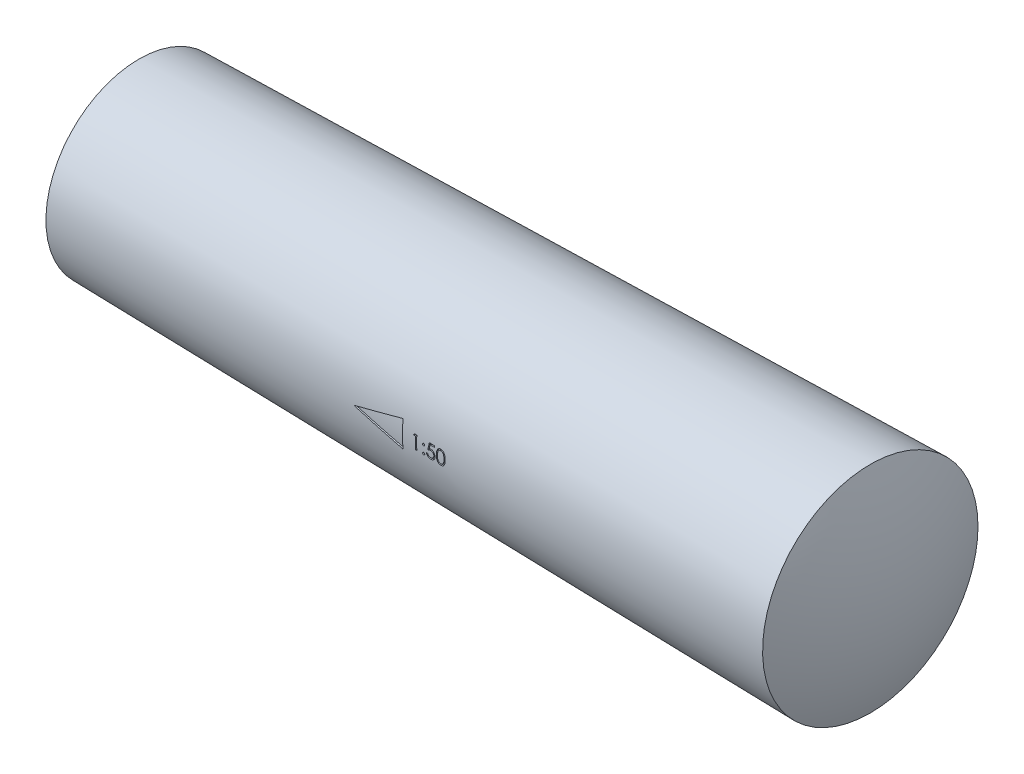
SolidWorks part; units mm, degrees
ref_plane "Front Plane" through (0, 0, 0) normal (0, 0, 1) x (1, 0, 0)
ref_plane "Top Plane" through (0, 0, 0) normal (0, 1, 0) x (1, 0, 0)
ref_plane "Right Plane" through (0, 0, 0) normal (1, 0, 0) x (0, 0, -1)
sketch "Sketch1" plane through (0, 0, 0) normal (1, 0, 0) x (0, 0, -1)
  circle A0 centre (0, 0) radius 7
  dimension "D1" = 14
extrude "Extrude1" add sketch "Sketch1" along normal mid plane 55
draft "Draft1" type of draft neutral plane draft angle 1.146 faces to draft 1 parameters "D1"=1.146
sketch "Sketch2" plane through (0, 0, 0) normal (0, 0, 1) x (1, 0, 0)
  line L0 (-27.5, 0) -> (-27.5, 7)
  line L1 (-27.5, 7) -> (-27.5, -7) construction
  line L2 (-27.5, 0) -> (-29.1, 0)
  line L3 (-29.1, 0) -> (-29.1, -7.55) construction
  line L4 (27.5, 0) -> (27.5, 8.1)
  line L5 (27.5, -8.1) -> (27.5, 8.1) construction
  line L6 (27.5, 0) -> (29.1, 0)
  line L7 (29.1, 0) -> (29.1, -7.55) construction
  line L8 (-27.5, -7) -> (27.5, -8.1) construction
  arc A0 (-29.1, 0) -> (-27.5, 7) centre (-12.9875, 0) cw
  arc A1 (29.1, 0) -> (27.5, 8.1) centre (7.7967, 0) ccw
  point P14 (0, -7.55)
revolve "Revolve1" add sketch "Sketch2" angle 360 about L2
sketch "Sketch5" plane through (0, 0, 0) normal (0, 0, 1) x (1, 0, 0)
  line L0 (0, 7.55) -> (0, -7.55) construction
  line L1 (27.5, 8.1) -> (-27.5, 7) construction
  line L2 (-27.5, -7) -> (27.5, -8.1) construction
ref_plane "Plane2" through (0, 0, 0) normal (-0.02, 0, 0.9998) x (0.9998, 0, 0.02)
sketch "Sketch6" plane through (0, 0, 0) normal (-0.02, 0, 0.9998) x (0.9998, 0, 0.02)
  line L0 (0, 0) -> (0, 1)
  line L1 (0, 7.55) -> (0, -7.55) construction
  line L2 (0, 1) -> (-3.7321, 0)
  line L3 (-3.7321, 0) -> (0, -1)
  line L4 (0, -1) -> (0, 0)
  line L5 (0, -0.5) -> (4, -0.5) construction
  text T0 "1:50" font "Century Gothic" height 1
  dimension "D1" = 2
  dimension "D2" = 30
  dimension "D3" = 4
wrap "Wrap2" sketch "Sketch6" wrap type deboss source sketch "Sketch6" thickness 0.1 parameters "D1"=0.1
equation "\"D2@Sketch2\" = \"D1@Sketch2\""
